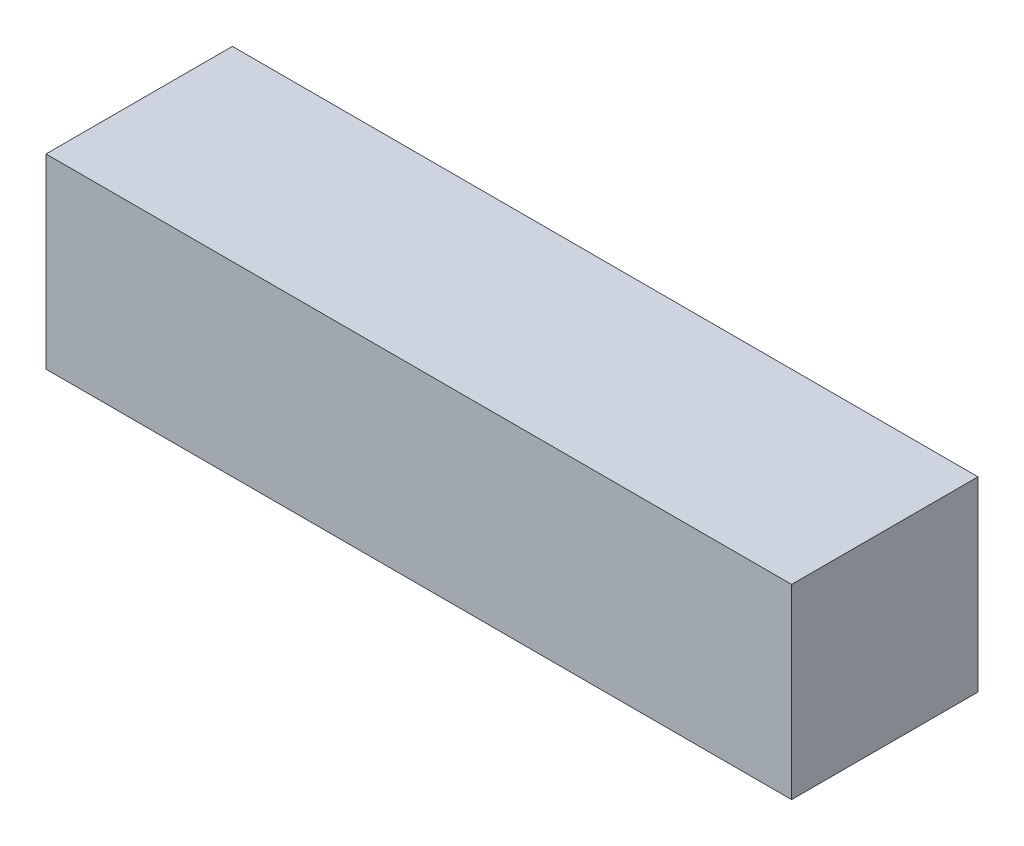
SolidWorks part; units mm, degrees
ref_plane "Face" through (0, 0, 0) normal (0, 0, 1) x (1, 0, 0)
ref_plane "Dessus" through (0, 0, 0) normal (0, 1, 0) x (1, 0, 0)
ref_plane "Droite" through (0, 0, 0) normal (1, 0, 0) x (0, 0, -1)
sketch "Esquisse1" plane through (0, 0, 0) normal (0, 0, 1) x (1, 0, 0)
  line L0 (6, 1.5) -> (-6, -1.5) construction
  line L1 (-6, 1.5) -> (6, 1.5)
  line L2 (-6, 1.5) -> (-6, -1.5)
  line L3 (-6, -1.5) -> (6, -1.5)
  line L4 (6, 1.5) -> (6, -1.5)
  dimension "D1" = 3
  dimension "D2" = 12
extrude "Extrusion1" add sketch "Esquisse1" along normal mid plane 3
